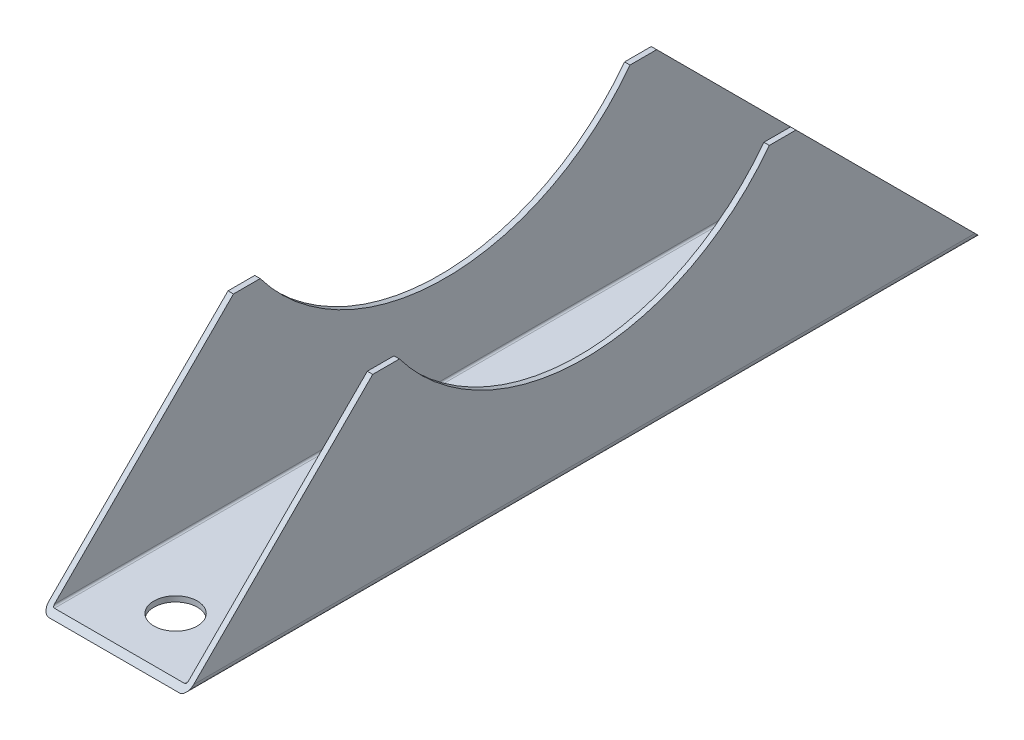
SolidWorks part; units mm, degrees
ref_plane "Plan de face" through (0, 0, 0) normal (0, 0, 1) x (1, 0, 0)
ref_plane "Plan de dessus" through (0, 0, 0) normal (0, 1, 0) x (1, 0, 0)
ref_plane "Plan de droite" through (0, 0, 0) normal (1, 0, 0) x (0, 0, -1)
sketch "Esquisse1" plane through (0, 0, 0) normal (0, 0, 1) x (1, 0, 0)
  line L0 (-20, 0) -> (-20, 51.5)
  line L1 (-20, 51.5) -> (-18.5, 51.5)
  line L2 (-18.5, 51.5) -> (-18.5, 1.5)
  line L3 (-18.5, 1.5) -> (18.5, 1.5)
  line L4 (18.5, 1.5) -> (18.5, 51.5)
  line L5 (18.5, 51.5) -> (20, 51.5)
  line L6 (20, 51.5) -> (20, 0)
  line L7 (20, 0) -> (-20, 0)
  point P7 (0, 0)
  dimension "D1" = 1.5
  dimension "D2" = 1.5
  dimension "D3" = 51.5
  dimension "D4" = 40
extrude "Extrusion1" add sketch "Esquisse1" along normal mid plane 220
sketch "Esquisse2" plane through (20, 0, 0) normal (1, 0, 0) x (0, 0, -1)
  line L0 (-110, 51.5) -> (-58.5, 51.5)
  line L1 (-110, 51.5) -> (110, 51.5) construction
  line L2 (-58.5, 51.5) -> (-110, 0)
  line L3 (-110, 0) -> (-110, 51.5)
  dimension "D1" = 45
extrude "Extrusion2" cut sketch "Esquisse2" against normal through all
sketch "Esquisse3" plane through (0, 1.5, 0) normal (0, 1, 0) x (1, 0, 0)
  circle A0 centre (0, -93) radius 6
  dimension "D2" = 12
  dimension "D1" = 93
extrude "Extrusion3" cut sketch "Esquisse3" against normal up to next
mirror "Symétrie1" about plane through (0, 0, 0) normal (0, 0, 1) of "Extrusion3", "Extrusion2"
sketch "Esquisse4" plane through (20, 0, 0) normal (1, 0, 0) x (0, 0, -1)
  line L0 (-51.1248, 51.5) -> (51.1248, 51.5)
  line L1 (-110, 0) -> (110, 0) construction
  line L2 (-58.5, 51.5) -> (58.5, 51.5) construction
  arc A0 (-51.1248, 51.5) -> (51.1248, 51.5) centre (0, 90) ccw
  dimension "D1" = 64
  dimension "D2" = 90
extrude "Extrusion4" cut sketch "Esquisse4" against normal through all
fillet "Congé1" radius 0.5 2 edges at (18.5, 1.5, 0) (-18.5, 1.5, 0)
fillet "Congé2" radius 2 2 edges at (20, 0, 0) (-20, 0, 0)
